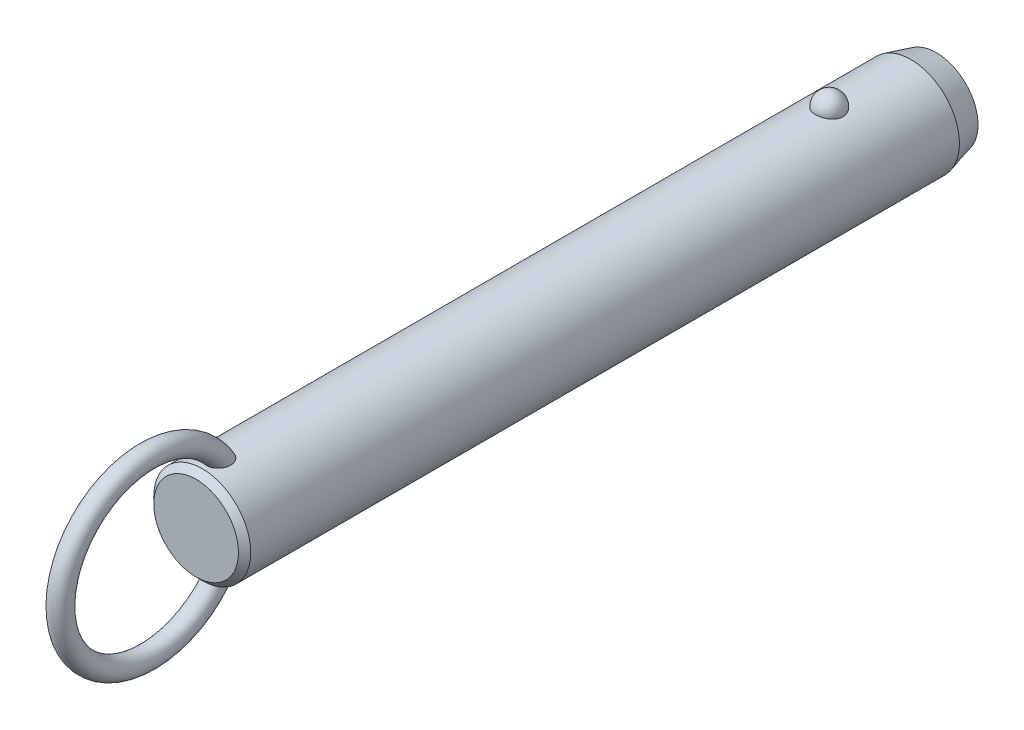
SolidWorks part; units mm, degrees
ref_plane "Front Plane" through (0, 0, 0) normal (0, 0, 1) x (1, 0, 0)
ref_plane "Top Plane" through (0, 0, 0) normal (0, 1, 0) x (1, 0, 0)
ref_plane "Right Plane" through (0, 0, 0) normal (1, 0, 0) x (0, 0, -1)
sketch "Sketch2" plane through (0, 0, 0) normal (0, 0, 1) x (1, 0, 0)
  circle A0 centre (0, 0) radius 9.5
  point P3 (0, 9.5)
  dimension "D1" = 19
extrude "Boss-Extrude1" add sketch "Sketch2" along normal blind 111.8
sketch "Sketch3" plane through (0, 0, 0) normal (0, 0, -1) x (-1, 0, 0)
  circle A0 centre (0, 0) radius 9.5
  dimension "D1" = 19
extrude "Boss-Extrude2" add sketch "Sketch3" along normal blind 23.7
chamfer "Chamfer1" distance 5 angle 15 1 edges at (-9.5, 0, -23.7)
sketch "Sketch12" plane through (0, 0, 0) normal (1, 0, 0) x (0, 0, -1)
  line L0 (-111.8, 9.5) -> (-111.8, -9.5) construction
  point P0 (-111.8, 0)
sketch "Sketch13" plane through (0, 0, 0) normal (1, 0, 0) x (0, 0, -1)
  circle A0 centre (-130.85, 0) radius 19.05
  point P2 (-111.8, 0)
  dimension "D1" = 38.1
sketch "Sketch14" plane through (0, 0, 0) normal (0, 1, 0) x (1, 0, 0)
  circle A0 centre (0, -113.8) radius 2
  point P2 (0, -111.8)
  dimension "D1" = 4
sweep "Sweep1" add profiles "Sketch14" path "Sketch13"
sketch "Sketch15" plane through (0, 0, 111.8) normal (0, 0, 1) x (1, 0, 0)
  circle A0 centre (0, 0) radius 9.5
  dimension "D1" = 19
extrude "Boss-Extrude3" add sketch "Sketch15" along normal blind 9.52
chamfer "Chamfer2" distance 1.2 angle 45 1 edges at (9.5, 0, 121.32)
sketch "Sketch18" plane through (0, 0, 0) normal (1, 0, 0) x (0, 0, -1)
  line L0 (18.7, 9.5) -> (-114.3378, 9.5) construction
  line L1 (2.7, 12.2) -> (2.7, 6.8)
  line L2 (-114.3378, -9.5) -> (18.7, -9.5) construction
  arc A0 (2.7, 12.2) -> (2.7, 6.8) centre (2.7, 9.5) ccw
  point P4 (0, 9.5)
  dimension "D1" = 21.7
revolve "Revolve1" add sketch "Sketch18" angle 360 about L1
